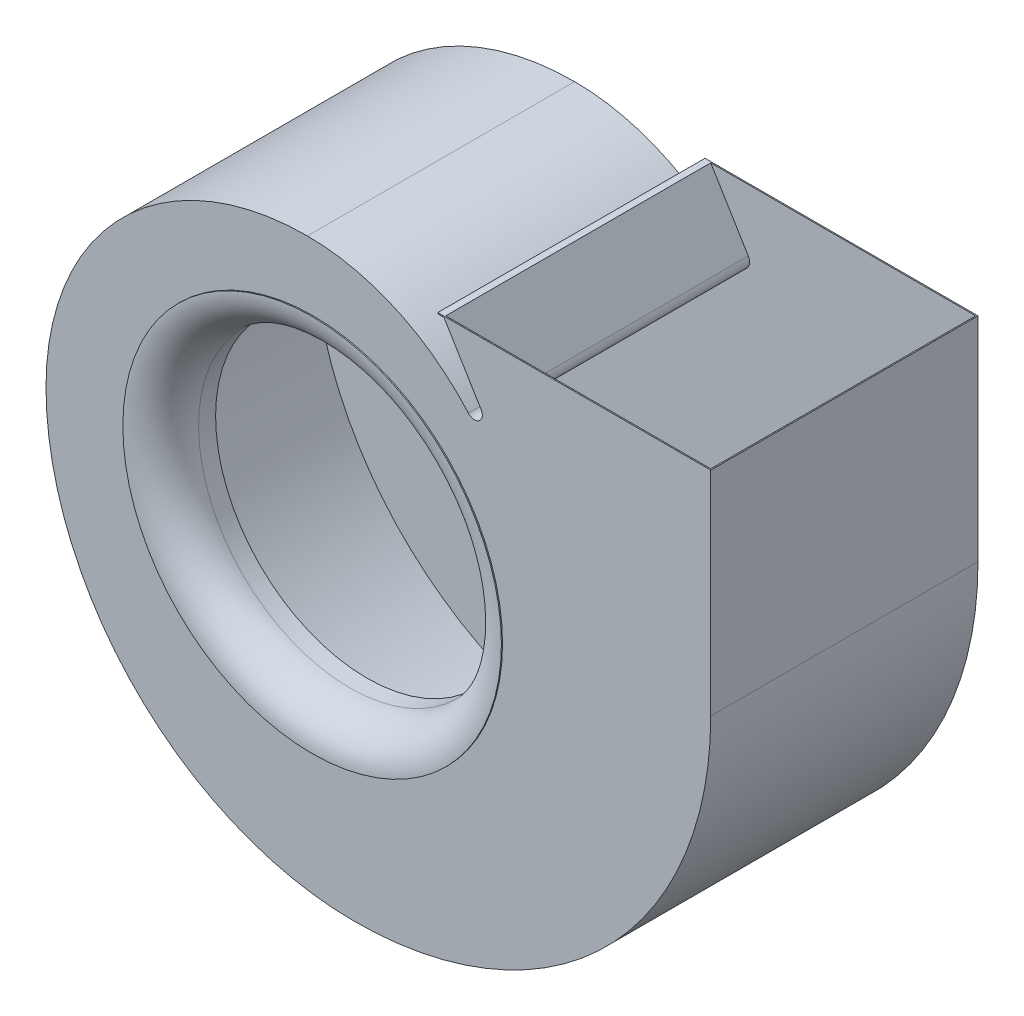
SolidWorks part; units mm, degrees
ref_plane "Front Plane" through (0, 0, 0) normal (0, 0, 1) x (1, 0, 0)
ref_plane "Top Plane" through (0, 0, 0) normal (0, 1, 0) x (1, 0, 0)
ref_plane "Right Plane" through (0, 0, 0) normal (1, 0, 0) x (0, 0, -1)
sketch "Sketch1" plane through (0, 0, 0) normal (0, 0, 1) x (1, 0, 0)
  line L0 (500, 31.25) -> (500, 312.5)
  line L1 (-31.25, 31.25) -> (31.25, 31.25) construction
  line L2 (-31.25, 31.25) -> (-31.25, -31.25) construction
  line L3 (-31.25, -31.25) -> (31.25, -31.25) construction
  line L4 (31.25, 31.25) -> (31.25, -31.25) construction
  line L5 (500, 312.5) -> (150, 312.5) construction
  line L6 (150, 312.5) -> (199.5789, 230.7211)
  line L7 (150, 312.5) -> (141, 312.5)
  line L8 (155.6885, 212.5) -> (255.2499, 212.5) construction
  arc A0 (180.2917, 216.5921) -> (-31.25, 312.5) centre (-31.25, 31.25) ccw
  arc A1 (-31.25, 312.5) -> (-375, -31.25) centre (-31.25, -31.25) ccw
  arc A2 (-375, -31.25) -> (31.25, -437.5) centre (31.25, -31.25) ccw
  arc A3 (31.25, -437.5) -> (500, 31.25) centre (31.25, 31.25) ccw
  arc A4 (180.2917, 216.5921) -> (199.5789, 230.7211) centre (189.3175, 224.5) ccw
  dimension "D5" = 562.5
  dimension "D6" = 687.5
  dimension "D7" = 812.5
  dimension "D8" = 937.5
  dimension "D10" = 24
  dimension "D1" = 31.25
  dimension "D2" = 31.25
  dimension "D3" = 62.5
  dimension "D4" = 62.5
  dimension "D9" = 350
  dimension "D11" = 100
  dimension "D12" = 9
extrude "Extrude-Thin1" add sketch "Sketch1" along normal blind 350 thin
sketch "Sketch2" plane through (0, 0, 0) normal (0, 0, -1) x (-1, 0, 0)
  line L1 (-149.1553, 311) -> (-198.2963, 229.9434) construction
  line L3 (-141, 311) -> (-141, 312.5) construction
  line L4 (-149.1553, 311) -> (-198.2963, 229.9434)
  line L5 (-141, 311) -> (-149.1553, 311) construction
  line L6 (-141, 311) -> (-141, 312.5)
  line L7 (-141, 311) -> (-149.1553, 311)
  line L8 (-501.5, 31.25) -> (-501.5, 312.5) construction
  line L9 (-501.5, 31.25) -> (-501.5, 312.5)
  line L10 (-501.5, 312.5) -> (-141, 312.5)
  arc A0 (-198.2963, 229.9434) -> (-181.4199, 217.5806) centre (-189.3175, 224.5) ccw construction
  arc A1 (31.25, 314) -> (-181.4199, 217.5806) centre (31.25, 31.25) ccw construction
  arc A2 (376.5, -31.25) -> (31.25, 314) centre (31.25, -31.25) ccw construction
  arc A3 (-31.25, -439) -> (376.5, -31.25) centre (-31.25, -31.25) ccw construction
  arc A4 (-501.5, 31.25) -> (-31.25, -439) centre (-31.25, 31.25) ccw construction
  arc A5 (-198.2963, 229.9434) -> (-181.4199, 217.5806) centre (-189.3175, 224.5) ccw
  arc A6 (31.25, 314) -> (-181.4199, 217.5806) centre (31.25, 31.25) ccw
  arc A7 (376.5, -31.25) -> (31.25, 314) centre (31.25, -31.25) ccw
  arc A8 (-31.25, -439) -> (376.5, -31.25) centre (-31.25, -31.25) ccw
  arc A9 (-501.5, 31.25) -> (-31.25, -439) centre (-31.25, 31.25) ccw
extrude "Extrude1" add sketch "Sketch2" along normal blind 1.5
sketch "Sketch3" plane through (0, 0, 350) normal (0, 0, 1) x (1, 0, 0)
  line L1 (149.1553, 311) -> (198.2963, 229.9434) construction
  line L3 (501.5, 31.25) -> (501.5, 312.5) construction
  line L4 (149.1553, 311) -> (198.2963, 229.9434)
  line L5 (501.5, 31.25) -> (501.5, 312.5)
  line L7 (141, 311) -> (141, 312.5) construction
  line L8 (141, 311) -> (149.1553, 311) construction
  line L9 (141, 311) -> (141, 312.5)
  line L10 (141, 311) -> (149.1553, 311)
  line L11 (141, 312.5) -> (501.5, 312.5)
  arc A0 (181.4199, 217.5806) -> (198.2963, 229.9434) centre (189.3175, 224.5) ccw construction
  arc A1 (181.4199, 217.5806) -> (-31.25, 314) centre (-31.25, 31.25) ccw construction
  arc A2 (-31.25, 314) -> (-376.5, -31.25) centre (-31.25, -31.25) ccw construction
  arc A3 (-376.5, -31.25) -> (31.25, -439) centre (31.25, -31.25) ccw construction
  arc A4 (31.25, -439) -> (501.5, 31.25) centre (31.25, 31.25) ccw construction
  arc A5 (181.4199, 217.5806) -> (198.2963, 229.9434) centre (189.3175, 224.5) ccw
  arc A6 (181.4199, 217.5806) -> (-31.25, 314) centre (-31.25, 31.25) ccw
  arc A7 (-31.25, 314) -> (-376.5, -31.25) centre (-31.25, -31.25) ccw
  arc A8 (-376.5, -31.25) -> (31.25, -439) centre (31.25, -31.25) ccw
  arc A9 (31.25, -439) -> (501.5, 31.25) centre (31.25, 31.25) ccw
extrude "Extrude2" add sketch "Sketch3" along normal blind 1.5
sketch "Sketch5" plane through (0, 0, 0) normal (1, 0, 0) x (0, 0, -1)
  line L0 (-304, 200) -> (-326.5, 200)
  line L1 (-326.5, 250) -> (-376.5, 250) construction
  line L2 (-376.5, 250) -> (-376.5, 0) construction
  line L3 (-304, 200) -> (-304, 0) construction
  line L6 (-304, 0) -> (-376.5, 0) construction
  line L7 (-350, 216.5921) -> (-350, 312.5) construction
  line L8 (-350, 216.5921) -> (-350, 312.5) construction
  arc A0 (-376.5, 250) -> (-326.5, 200) centre (-326.5, 250) ccw
  dimension "D2" = 100
  dimension "D1" = 200
  dimension "D3" = 72.5
  dimension "D4" = 46
revolve "Revolve-Thin1" add sketch "Sketch5" angle 360 about L6
split "Split1" resulting bodies 106
combine bodies "Combine1" operation type add bodies to combine 105 106
